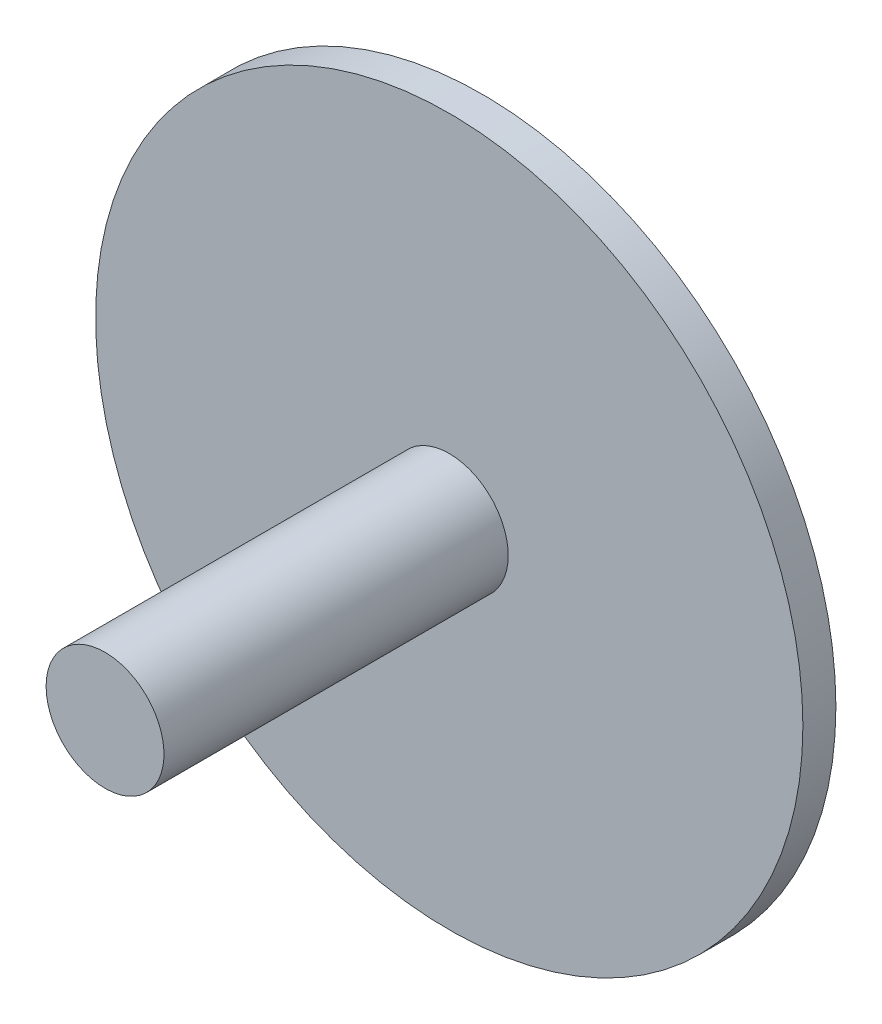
SolidWorks part; units mm, degrees
ref_plane "Front Plane" through (0, 0, 0) normal (0, 0, 1) x (1, 0, 0)
ref_plane "Top Plane" through (0, 0, 0) normal (0, 1, 0) x (1, 0, 0)
ref_plane "Right Plane" through (0, 0, 0) normal (1, 0, 0) x (0, 0, -1)
sketch "Sketch1" plane through (0, 0, 0) normal (0, 1, 0) x (1, 0, 0)
  line L0 (0, 0) -> (5.5562, 0)
  line L1 (5.5562, 0) -> (5.5563, -25.4)
  line L2 (5.5563, -25.4) -> (2.3813, -25.4)
  line L3 (2.3813, -25.4) -> (2.3813, -5.08)
  line L4 (2.3813, -5.08) -> (0, -5.08)
  line L5 (0, -5.08) -> (0, 0)
  dimension "D1" = 25.4
  dimension "D2" = 5.5562
  dimension "D3" = 3.175
  dimension "D4" = 5.08
revolve "Revolve1" add sketch "Sketch1" angle 360 about L1
sketch "Sketch2" plane through (0, 0, 5.08) normal (0, 0, 1) x (1, 0, 0)
  circle A0 centre (5.5562, 0) radius 19.05
  circle A1 centre (5.5562, 0) radius 5.5563 construction
  dimension "D1" = 38.1
extrude "Boss-Extrude1" add sketch "Sketch2" along normal blind 1.778 contours A0
